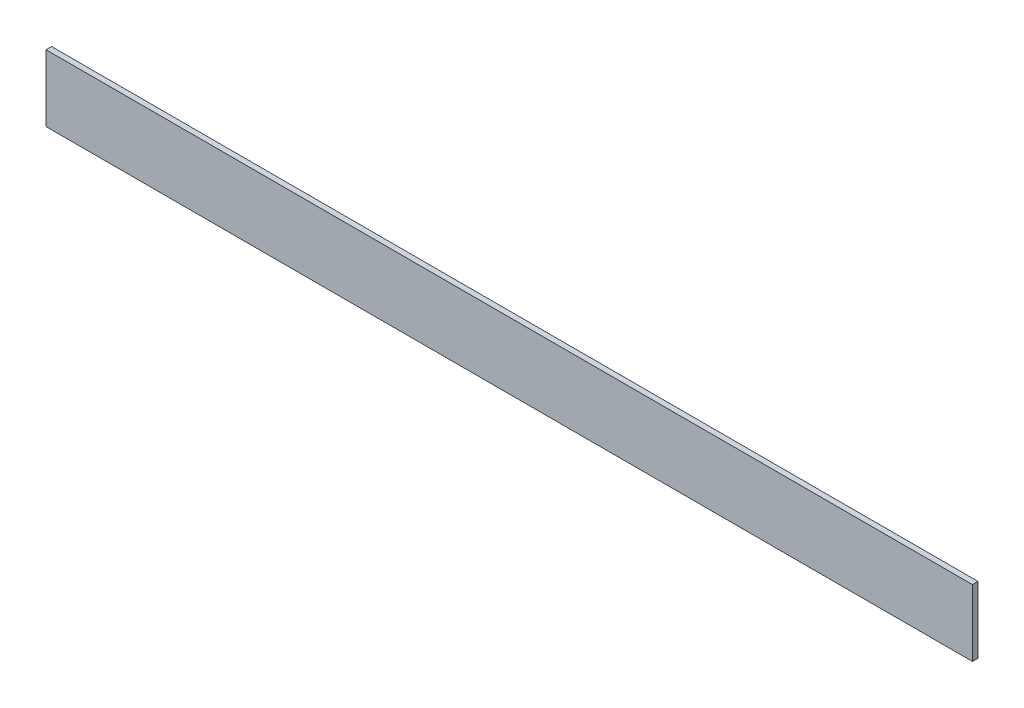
SolidWorks part; units mm, degrees
ref_plane "Front Plane" through (0, 0, 0) normal (0, 0, 1) x (1, 0, 0)
ref_plane "Top Plane" through (0, 0, 0) normal (0, 1, 0) x (1, 0, 0)
ref_plane "Right Plane" through (0, 0, 0) normal (1, 0, 0) x (0, 0, -1)
sketch "Sketch1" plane through (0, 0, 0) normal (0, 0, 1) x (1, 0, 0)
  line L1 (-530.225, -38.1) -> (530.225, -38.1)
  line L2 (-530.225, -38.1) -> (-530.225, 38.1)
  line L3 (-530.225, 38.1) -> (530.225, 38.1)
  line L4 (530.225, -38.1) -> (530.225, 38.1)
  line L5 (-530.225, -38.1) -> (530.225, 38.1) construction
  line L6 (-530.225, 38.1) -> (530.225, -38.1) construction
  point P0 (0, 0)
  dimension "D1" = 76.2
  dimension "D2" = 1060.45
extrude "Boss-Extrude1" add sketch "Sketch1" along normal blind 6.35
